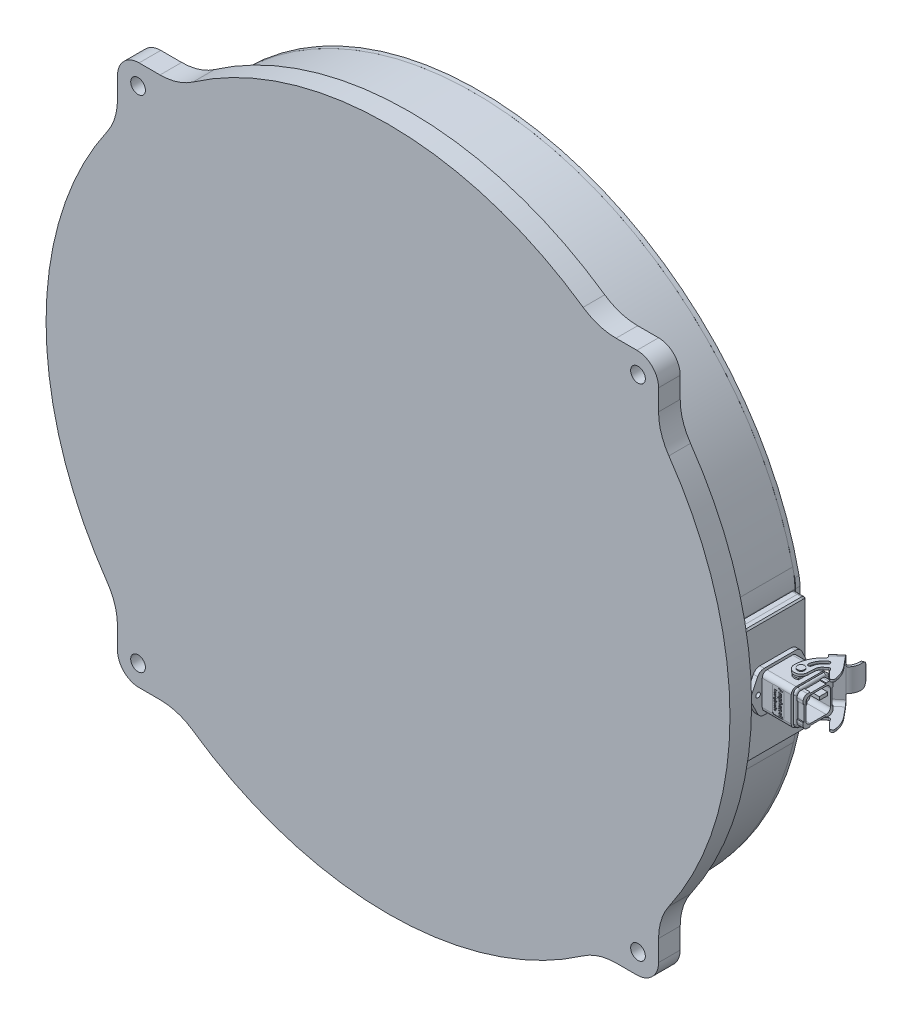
SolidWorks part; units mm, degrees
other "Kamera1"
other "Kamera2"
other "Kamera3"
ref_plane "Ebene vorne" through (0, 0, 0) normal (0, 0, 1) x (1, 0, 0)
ref_plane "Ebene oben" through (0, 0, 0) normal (0, 1, 0) x (1, 0, 0)
ref_plane "Ebene rechts" through (0, 0, 0) normal (1, 0, 0) x (0, 0, -1)
imported_body "P001088-1/P001089-1/P001103-1-solid1"
imported_body "P001088-1/P001089-1/P000249-1-solid1"
imported_body "P001088-1/P001089-1/P000249-1-solid2"
imported_body "P001088-1/P001089-1/P000249-1-solid3"
imported_body "P001088-1/P001089-1/P003335-1-solid1"
imported_body "P001088-1/P001089-1/P000244-1-solid1"
imported_body "P001088-1/P001089-1/P001476-1-solid1"
imported_body "P001088-1/P001089-1/P000254-2-solid1"
imported_body "P001088-1/P001089-1/P001476-2-solid1"
other "Fläche verschieben2" parameters "D1"=3
sketch "Skizze1" plane through (0, 0, -56) normal (0, 0, -1) x (-1, 0, 0)
  line L0 (-219, -147.9931) -> (-219, -57.0069)
  line L1 (-219, -130) -> (-219, -75) construction
  line L2 (217, -57.0069) -> (217, -147.9931)
  line L3 (217, -75) -> (217, -130) construction
  line L4 (220.5, -150.7592) -> (220.5, -54.2408)
  line L5 (220.5, -142.5) -> (220.5, -130.5) construction
  line L6 (-223.5, -59.084) -> (-223.5, -145.916)
  line L7 (-223.5, -130.5) -> (-223.5, -142.5) construction
  arc A0 (217, -57.0069) -> (-219, -57.0069) centre (-1, -102.5) ccw
  arc A1 (215.6403, -50.919) -> (-217.6403, -50.919) centre (-1, -102.5) ccw construction
  arc A2 (220.5, -54.2408) -> (-223.5, -59.084) centre (-1, -102.5) ccw
  arc A3 (219.5315, -49.9925) -> (-221.5315, -49.9925) centre (-1, -102.5) ccw construction
  arc A4 (-223.5, -145.916) -> (220.5, -150.7592) centre (-1, -102.5) ccw
  arc A5 (-219, -147.9931) -> (217, -147.9931) centre (-1, -102.5) ccw
extrude "Aufsatz-Linear austragen10" add sketch "Skizze1" along normal blind 3 separate body
fillet "Verrundung1" radius 30 4 edges at (223.5, -59.084, -57.5) (223.5, -145.916, -57.5) (-220.5, -54.2408, -57.5) (-220.5, -150.7592, -57.5)
